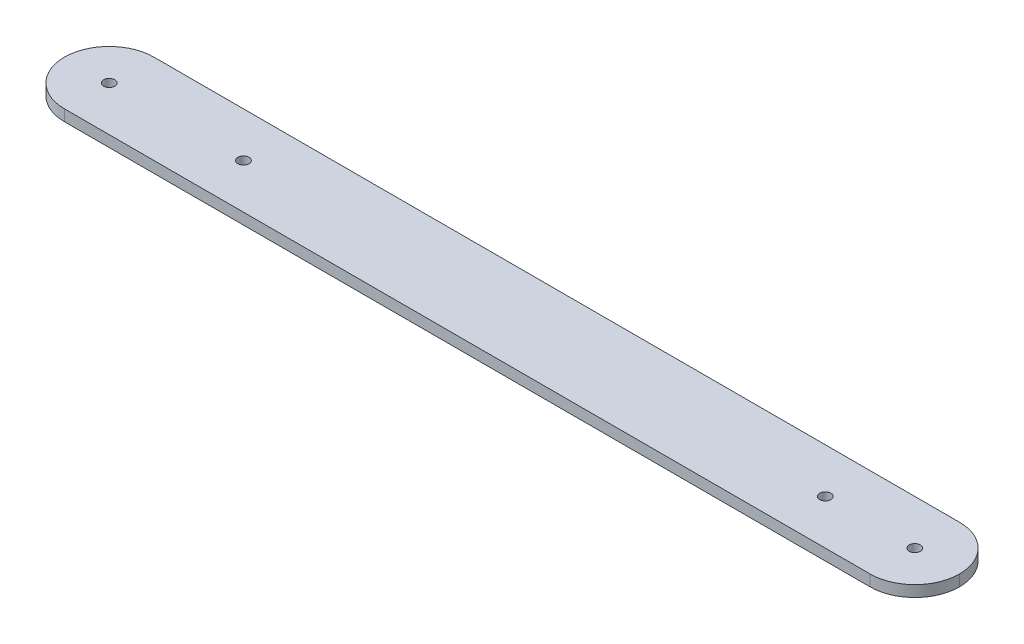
SolidWorks part; units mm, degrees
ref_plane "Front Plane" through (0, 0, 0) normal (0, 0, 1) x (1, 0, 0)
ref_plane "Top Plane" through (0, 0, 0) normal (0, 1, 0) x (1, 0, 0)
ref_plane "Right Plane" through (0, 0, 0) normal (1, 0, 0) x (0, 0, -1)
sketch "Sketch1" plane through (0, 0, 0) normal (0, 1, 0) x (1, 0, 0)
  line L1 (0, 0) -> (254, 0)
  line L2 (0, 0) -> (0, 25.4)
  line L3 (0, 25.4) -> (254, 25.4)
  line L4 (254, 0) -> (254, 25.4)
  dimension "D1" = 254
  dimension "D2" = 25.4
extrude "Boss-Extrude1" add sketch "Sketch1" along normal blind 3.175
sketch "Sketch2" plane through (0, 3.175, 0) normal (0, 1, 0) x (1, 0, 0)
  line L0 (254, 25.4) -> (0, 25.4) construction
  line L1 (0, 25.4) -> (0, 0) construction
  circle A0 centre (12.7, 12.7) radius 1.5875
  circle A1 centre (50.8, 12.7) radius 1.5875
  dimension "D1" = 3.175
  dimension "D2" = 3.175
  dimension "D3" = 12.7
  dimension "D4" = 12.7
  dimension "D5" = 38.1
  dimension "D6" = 38.1
extrude "Cut-Extrude1" cut sketch "Sketch2" against normal blind 3.175
fillet "Fillet1" radius 12.7 4 edges at (254, 1.5875, -25.4) (254, 1.5875, 0) (0, 1.5875, 0) (0, 1.5875, -25.4)
sketch "Sketch3" plane through (0, 3.175, 0) normal (0, 1, 0) x (1, 0, 0)
  circle A0 centre (241.3, 12.7) radius 1.5875
  circle A1 centre (215.9, 12.7) radius 1.5875
  point P5 (218.6835, 1.1391)
  dimension "D1" = 3.175
  dimension "D2" = 3.175
  dimension "D3" = 25.4
  dimension "D4" = 0
extrude "Cut-Extrude2" cut sketch "Sketch3" against normal blind 7.62
